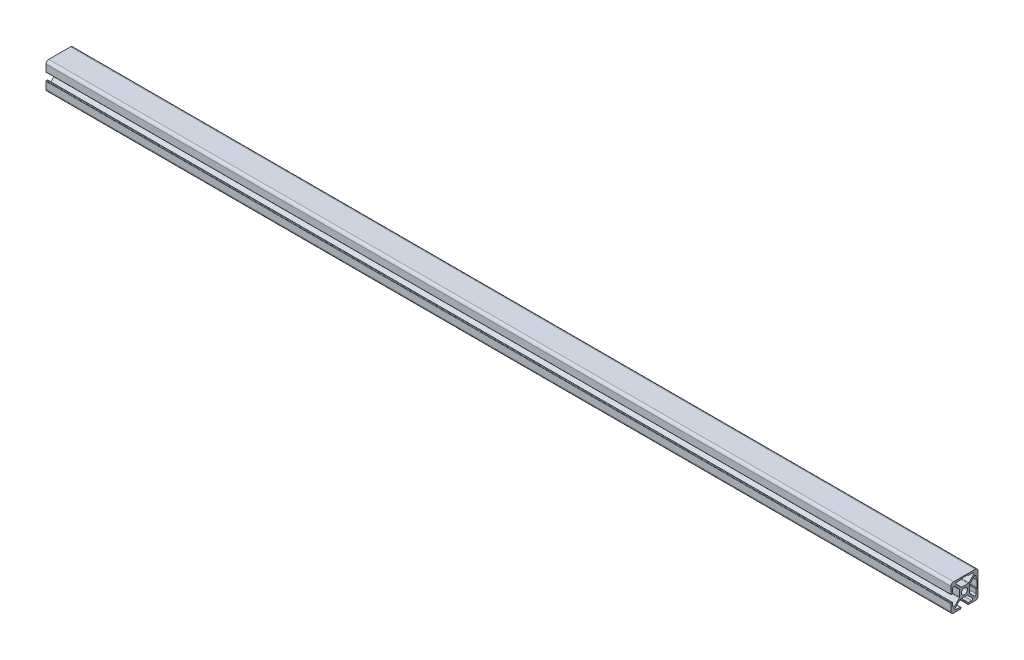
SolidWorks part; units mm, degrees
ref_plane "Ebene vorne" through (0, 0, 0) normal (0, 0, 1) x (1, 0, 0)
ref_plane "Ebene oben" through (0, 0, 0) normal (0, 1, 0) x (1, 0, 0)
ref_plane "Ebene rechts" through (0, 0, 0) normal (1, 0, 0) x (0, 0, -1)
sketch "Skizze1" plane through (0, 0, 0) normal (0, 1, 0) x (1, 0, 0)
  line L0 (0, 0) -> (1000, 0)
  dimension "D1" = 1000
other "Strukturbauteil1"
ref_plane "Ebene1" through (0, 0, 0) normal (1, 0, 0) x (0, 0, -1)
sketch "Model" plane through (0, 0, 0) normal (1, 0, 0) x (0, 0, -1)
  line L0 (13.8, 3.7) -> (13.8, -3.7)
  line L1 (13, -4.5) -> (13, -9.1023)
  line L2 (10.7846, -10.0199) -> (5.6929, -4.9282)
  line L3 (5.4, -4.2211) -> (5.4, 3.0211)
  line L4 (5.6929, 3.7282) -> (10.7846, 8.8199)
  line L5 (13, 7.9023) -> (13, 4.5)
  line L6 (-14.5, 4) -> (-13.5, 4)
  line L7 (-13, 4.5) -> (-13, 9.1023)
  line L8 (-10.7846, 10.0199) -> (-5.6929, 4.9282)
  line L9 (-5.4, 4.2211) -> (-5.4, -3.0211)
  line L10 (-5.6929, -3.7282) -> (-10.7846, -8.8199)
  line L11 (-13, -7.9023) -> (-13, -4.5)
  line L12 (-13.5, -4) -> (-14.5, -4)
  line L13 (-15, -4.5) -> (-15, -12)
  line L14 (-12, -15) -> (-4.5, -15)
  line L15 (-4, -14.5) -> (-4, -13.5)
  line L16 (-4.5, -13) -> (-9.1023, -13)
  line L17 (-10.0199, -10.7846) -> (-4.9282, -5.6929)
  line L18 (-4.2211, -5.4) -> (3.0211, -5.4)
  line L19 (3.7282, -5.6929) -> (8.8199, -10.7846)
  line L20 (7.9023, -13) -> (4.5, -13)
  line L21 (4, -13.5) -> (4, -14.5)
  line L22 (4.5, -15) -> (12, -15)
  line L23 (15, -12) -> (15, 12)
  line L24 (12, 15) -> (-12, 15)
  line L25 (-15, 12) -> (-15, 4.5)
  line L26 (3.7, 13.8) -> (-3.7, 13.8)
  line L27 (-4.5, 13) -> (-7.9023, 13)
  line L28 (-8.8199, 10.7846) -> (-3.7282, 5.6929)
  line L29 (-3.0211, 5.4) -> (4.2211, 5.4)
  line L30 (4.9282, 5.6929) -> (10.0199, 10.7846)
  line L31 (9.1023, 13) -> (4.5, 13)
  line L33 (15, 15) -> (-15, 15) construction
  line L34 (15, 15) -> (15, -15) construction
  line L35 (15, -15) -> (-15, -15) construction
  line L36 (-15, 15) -> (-15, -15) construction
  line L37 (15, 15) -> (-15, -15) construction
  line L38 (15, -15) -> (-15, 15) construction
  circle A0 centre (0, 0) radius 3.4
  arc A1 (13.8, 3.7) -> (13.5, 4) centre (13.5, 3.7) ccw
  arc A2 (13.5, -4) -> (13.8, -3.7) centre (13.5, -3.7) ccw
  arc A3 (13.5, -4) -> (13, -4.5) centre (13.5, -4.5) ccw
  arc A4 (10.7846, -10.0199) -> (13, -9.1023) centre (11.7023, -9.1023) ccw
  arc A5 (5.4, -4.2211) -> (5.6929, -4.9282) centre (6.4, -4.2211) ccw
  arc A6 (5.6929, 3.7282) -> (5.4, 3.0211) centre (6.4, 3.0211) ccw
  arc A7 (13, 7.9023) -> (10.7846, 8.8199) centre (11.7023, 7.9023) ccw
  arc A8 (13, 4.5) -> (13.5, 4) centre (13.5, 4.5) ccw
  arc A9 (-15, 4.5) -> (-14.5, 4) centre (-14.5, 4.5) ccw
  arc A10 (-13.5, 4) -> (-13, 4.5) centre (-13.5, 4.5) ccw
  arc A11 (-10.7846, 10.0199) -> (-13, 9.1023) centre (-11.7023, 9.1023) ccw
  arc A12 (-5.4, 4.2211) -> (-5.6929, 4.9282) centre (-6.4, 4.2211) ccw
  arc A13 (-5.6929, -3.7282) -> (-5.4, -3.0211) centre (-6.4, -3.0211) ccw
  arc A14 (-13, -7.9023) -> (-10.7846, -8.8199) centre (-11.7023, -7.9023) ccw
  arc A15 (-13, -4.5) -> (-13.5, -4) centre (-13.5, -4.5) ccw
  arc A16 (-14.5, -4) -> (-15, -4.5) centre (-14.5, -4.5) ccw
  arc A17 (-15, -12) -> (-12, -15) centre (-12, -12) ccw
  arc A18 (-4.5, -15) -> (-4, -14.5) centre (-4.5, -14.5) ccw
  arc A19 (-4, -13.5) -> (-4.5, -13) centre (-4.5, -13.5) ccw
  arc A20 (-10.0199, -10.7846) -> (-9.1023, -13) centre (-9.1023, -11.7023) ccw
  arc A21 (-4.2211, -5.4) -> (-4.9282, -5.6929) centre (-4.2211, -6.4) ccw
  arc A22 (3.7282, -5.6929) -> (3.0211, -5.4) centre (3.0211, -6.4) ccw
  arc A23 (7.9023, -13) -> (8.8199, -10.7846) centre (7.9023, -11.7023) ccw
  arc A24 (4.5, -13) -> (4, -13.5) centre (4.5, -13.5) ccw
  arc A25 (4, -14.5) -> (4.5, -15) centre (4.5, -14.5) ccw
  arc A26 (12, -15) -> (15, -12) centre (12, -12) ccw
  arc A27 (15, 12) -> (12, 15) centre (12, 12) ccw
  arc A28 (-12, 15) -> (-15, 12) centre (-12, 12) ccw
  arc A29 (4, 13.5) -> (3.7, 13.8) centre (3.7, 13.5) ccw
  arc A30 (-3.7, 13.8) -> (-4, 13.5) centre (-3.7, 13.5) ccw
  arc A31 (-4.5, 13) -> (-4, 13.5) centre (-4.5, 13.5) ccw
  arc A32 (-7.9023, 13) -> (-8.8199, 10.7846) centre (-7.9023, 11.7023) ccw
  arc A33 (-3.7282, 5.6929) -> (-3.0211, 5.4) centre (-3.0211, 6.4) ccw
  arc A34 (4.2211, 5.4) -> (4.9282, 5.6929) centre (4.2211, 6.4) ccw
  arc A35 (10.0199, 10.7846) -> (9.1023, 13) centre (9.1023, 11.7023) ccw
  arc A36 (4, 13.5) -> (4.5, 13) centre (4.5, 13.5) ccw
  point P110 (-15, 0)
  point P111 (0, -15)
  point P112 (15, -0.2673)
  point P113 (0, 15)
  point P114 (0, 0)
